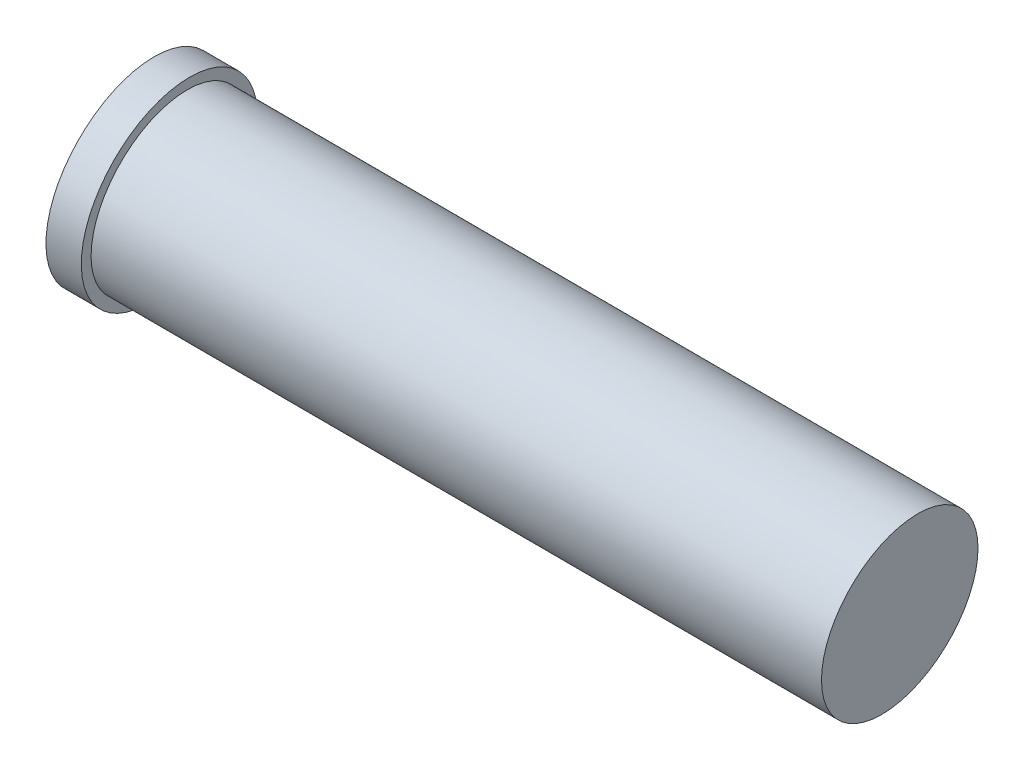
SolidWorks part; units mm, degrees
ref_plane "Alzado" through (0, 0, 0) normal (0, 0, 1) x (1, 0, 0)
ref_plane "Planta" through (0, 0, 0) normal (0, 1, 0) x (1, 0, 0)
ref_plane "Vista lateral" through (0, 0, 0) normal (1, 0, 0) x (0, 0, -1)
sketch3d "Sk_Puno"
  line L0 (250.774, 39.9286, -26.4554) -> (379.4801, 26.798, -39.196)
  dimension "D1" = 130
sweep "Puno" add path "Sk_Puno" parameters "D3"=32
sketch3d "Sk_Collarin"
  line L0 (250.774, 39.9286, -26.4554) -> (256.7143, 39.3226, -27.0434)
  dimension "D1" = 6
sweep "Collarin" add path "Sk_Collarin" parameters "D3"=36
sketch3d "Sk_Agujero_puno"
  line L0 (249.7839, 40.0296, -26.3574) -> (377.5, 27, -39)
  dimension "D1" = 129
sweep "Agujero_puno" cut path "Sk_Agujero_puno" parameters "D3"=22.2
